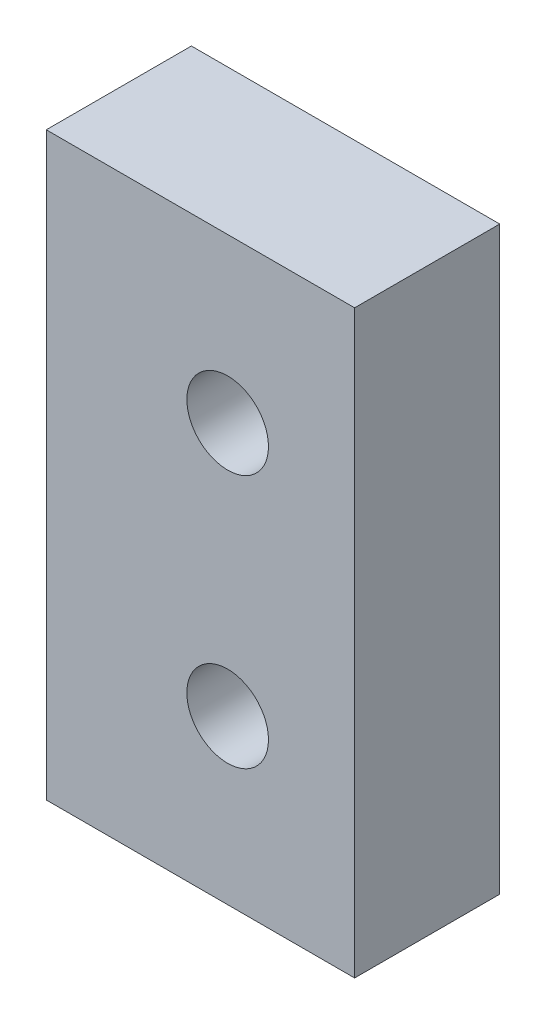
SolidWorks part; units mm, degrees
ref_plane "前视基准面" through (0, 0, 0) normal (0, 0, 1) x (1, 0, 0)
ref_plane "上视基准面" through (0, 0, 0) normal (0, 1, 0) x (1, 0, 0)
ref_plane "右视基准面" through (0, 0, 0) normal (1, 0, 0) x (0, 0, -1)
sketch "草图2" plane through (0, 0, 0) normal (0, 0, 1) x (1, 0, 0)
  line L0 (17, -32) -> (17, 0)
  line L1 (0, -32) -> (0, 0)
  line L2 (0, 0) -> (17, 0)
  line L3 (0, -32) -> (17, -32)
  circle A0 centre (10, -9) radius 2.25
  circle A1 centre (10, -23) radius 2.25
extrude "凸台-拉伸1" add sketch "草图2" along normal blind 8
